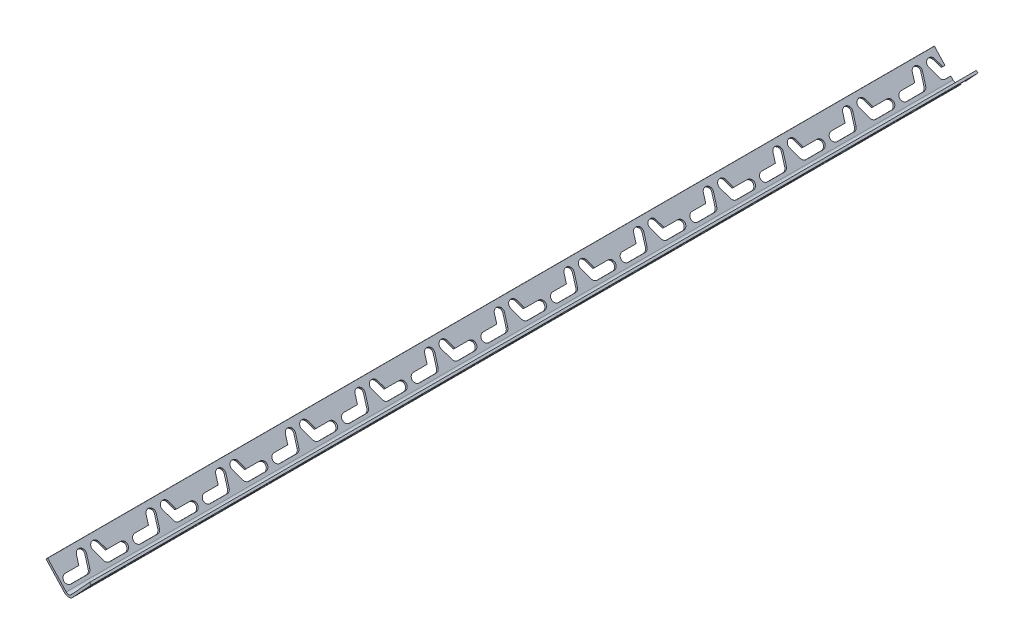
SolidWorks part; units mm, degrees
ref_plane "Face" through (0, 0, 0) normal (0, 0, 1) x (1, 0, 0)
ref_plane "Dessus" through (0, 0, 0) normal (0, 1, 0) x (1, 0, 0)
ref_plane "Droite" through (0, 0, 0) normal (1, 0, 0) x (0, 0, -1)
sketch "Esquisse1" plane through (0, 0, 0) normal (0, 0, 1) x (1, 0, 0)
  line L0 (-20.393, 14.6474) -> (-3.6671, -3.3988)
  line L1 (3.6671, -3.3988) -> (20.393, 14.6474)
  line L2 (20.393, 14.6474) -> (18.9261, 16.0069)
  line L3 (18.9261, 16.0069) -> (2.2003, -2.0393)
  line L4 (-2.2003, -2.0393) -> (-18.9261, 16.0069)
  line L5 (-18.9261, 16.0069) -> (-20.393, 14.6474)
  arc A0 (2.2003, -2.0393) -> (-2.2003, -2.0393) centre (0, 0) cw
  arc A1 (3.6671, -3.3988) -> (-3.6671, -3.3988) centre (0, 0) cw
  point P10 (0, -7.3555)
  dimension "D5" = 3
  dimension "D6" = 5
  dimension "D1" = 30
  dimension "D2" = 30
  dimension "D3" = 2
  dimension "D4" = 2
extrude "Extrusion1" add sketch "Esquisse1" along normal blind 800
sketch "Esquisse2" plane through (-2.2003, -2.0393, 0) normal (0.7334, 0.6798, 0) x (0, 0, -1)
  line L0 (-793.6651, 2.8299) -> (-778.6651, 2.8299)
  line L1 (-793.6651, 10.5869) -> (-781.3809, 10.5869)
  line L2 (-775.0205, 5.3818) -> (-771.6003, 14.7788)
  line L3 (-781.3809, 10.5869) -> (-778.8895, 17.4318)
  line L4 (-800, 24.6053) -> (0, 24.6053) construction
  line L5 (-765.8895, 14.7788) -> (-762.4693, 5.3818)
  line L6 (-758.8247, 2.8299) -> (-743.8247, 2.8299)
  line L7 (-756.109, 10.5869) -> (-743.8247, 10.5869)
  line L8 (-758.6003, 17.4318) -> (-756.109, 10.5869)
  line L9 (-730.8247, 2.8299) -> (-715.8247, 2.8299)
  line L10 (-730.8247, 10.5869) -> (-718.5405, 10.5869)
  line L11 (-712.1801, 5.3818) -> (-708.7599, 14.7788)
  line L12 (-718.5405, 10.5869) -> (-716.0491, 17.4318)
  line L13 (-703.0491, 14.7788) -> (-699.6289, 5.3818)
  line L14 (-695.9843, 2.8299) -> (-680.9843, 2.8299)
  line L15 (-693.2686, 10.5869) -> (-680.9843, 10.5869)
  line L16 (-695.7599, 17.4318) -> (-693.2686, 10.5869)
  line L17 (-667.9843, 2.8299) -> (-652.9843, 2.8299)
  line L18 (-667.9843, 10.5869) -> (-655.7001, 10.5869)
  line L19 (-649.3397, 5.3818) -> (-645.9195, 14.7788)
  line L20 (-655.7001, 10.5869) -> (-653.2087, 17.4318)
  line L21 (-640.2087, 14.7788) -> (-636.7885, 5.3818)
  line L22 (-633.1439, 2.8299) -> (-618.1439, 2.8299)
  line L23 (-630.4282, 10.5869) -> (-618.1439, 10.5869)
  line L24 (-632.9195, 17.4318) -> (-630.4282, 10.5869)
  line L25 (-605.1439, 2.8299) -> (-590.1439, 2.8299)
  line L26 (-605.1439, 10.5869) -> (-592.8597, 10.5869)
  line L27 (-586.4993, 5.3818) -> (-583.0791, 14.7788)
  line L28 (-592.8597, 10.5869) -> (-590.3683, 17.4318)
  line L29 (-577.3683, 14.7788) -> (-573.9481, 5.3818)
  line L30 (-570.3035, 2.8299) -> (-555.3035, 2.8299)
  line L31 (-567.5878, 10.5869) -> (-555.3035, 10.5869)
  line L32 (-570.0791, 17.4318) -> (-567.5878, 10.5869)
  line L33 (-542.3035, 2.8299) -> (-527.3035, 2.8299)
  line L34 (-542.3035, 10.5869) -> (-530.0193, 10.5869)
  line L35 (-523.6589, 5.3818) -> (-520.2387, 14.7788)
  line L36 (-530.0193, 10.5869) -> (-527.5279, 17.4318)
  line L37 (-514.5279, 14.7788) -> (-511.1077, 5.3818)
  line L38 (-507.4631, 2.8299) -> (-492.4631, 2.8299)
  line L39 (-504.7473, 10.5869) -> (-492.4631, 10.5869)
  line L40 (-507.2387, 17.4318) -> (-504.7473, 10.5869)
  line L41 (-479.4631, 2.8299) -> (-464.4631, 2.8299)
  line L42 (-479.4631, 10.5869) -> (-467.1789, 10.5869)
  line L43 (-460.8185, 5.3818) -> (-457.3983, 14.7788)
  line L44 (-467.1789, 10.5869) -> (-464.6875, 17.4318)
  line L45 (-451.6875, 14.7788) -> (-448.2673, 5.3818)
  line L46 (-444.6227, 2.8299) -> (-429.6227, 2.8299)
  line L47 (-441.9069, 10.5869) -> (-429.6227, 10.5869)
  line L48 (-444.3983, 17.4318) -> (-441.9069, 10.5869)
  line L49 (-416.6227, 2.8299) -> (-401.6227, 2.8299)
  line L50 (-416.6227, 10.5869) -> (-404.3385, 10.5869)
  line L51 (-397.9781, 5.3818) -> (-394.5579, 14.7788)
  line L52 (-404.3385, 10.5869) -> (-401.8471, 17.4318)
  line L53 (-388.8471, 14.7788) -> (-385.4269, 5.3818)
  line L54 (-381.7823, 2.8299) -> (-366.7823, 2.8299)
  line L55 (-379.0665, 10.5869) -> (-366.7823, 10.5869)
  line L56 (-381.5579, 17.4318) -> (-379.0665, 10.5869)
  line L57 (-353.7823, 2.8299) -> (-338.7823, 2.8299)
  line L58 (-353.7823, 10.5869) -> (-341.4981, 10.5869)
  line L59 (-335.1377, 5.3818) -> (-331.7175, 14.7788)
  line L60 (-341.4981, 10.5869) -> (-339.0067, 17.4318)
  line L61 (-326.0067, 14.7788) -> (-322.5865, 5.3818)
  line L62 (-318.9419, 2.8299) -> (-303.9419, 2.8299)
  line L63 (-316.2261, 10.5869) -> (-303.9419, 10.5869)
  line L64 (-318.7175, 17.4318) -> (-316.2261, 10.5869)
  line L65 (-290.9419, 2.8299) -> (-275.9419, 2.8299)
  line L66 (-290.9419, 10.5869) -> (-278.6577, 10.5869)
  line L67 (-272.2973, 5.3818) -> (-268.8771, 14.7788)
  line L68 (-278.6577, 10.5869) -> (-276.1663, 17.4318)
  line L69 (-263.1663, 14.7788) -> (-259.7461, 5.3818)
  line L70 (-256.1015, 2.8299) -> (-241.1015, 2.8299)
  line L71 (-253.3857, 10.5869) -> (-241.1015, 10.5869)
  line L72 (-255.8771, 17.4318) -> (-253.3857, 10.5869)
  line L73 (-228.1015, 2.8299) -> (-213.1015, 2.8299)
  line L74 (-228.1015, 10.5869) -> (-215.8172, 10.5869)
  line L75 (-209.4569, 5.3818) -> (-206.0367, 14.7788)
  line L76 (-215.8172, 10.5869) -> (-213.3259, 17.4318)
  line L77 (-200.3259, 14.7788) -> (-196.9057, 5.3818)
  line L78 (-193.2611, 2.8299) -> (-178.2611, 2.8299)
  line L79 (-190.5453, 10.5869) -> (-178.2611, 10.5869)
  line L80 (-193.0367, 17.4318) -> (-190.5453, 10.5869)
  line L81 (-165.2611, 2.8299) -> (-150.2611, 2.8299)
  line L82 (-165.2611, 10.5869) -> (-152.9768, 10.5869)
  line L83 (-146.6165, 5.3818) -> (-143.1963, 14.7788)
  line L84 (-152.9768, 10.5869) -> (-150.4855, 17.4318)
  line L85 (-137.4855, 14.7788) -> (-134.0653, 5.3818)
  line L86 (-130.4207, 2.8299) -> (-115.4207, 2.8299)
  line L87 (-127.7049, 10.5869) -> (-115.4207, 10.5869)
  line L88 (-130.1963, 17.4318) -> (-127.7049, 10.5869)
  line L89 (-102.4207, 2.8299) -> (-87.4207, 2.8299)
  line L90 (-102.4207, 10.5869) -> (-90.1364, 10.5869)
  line L91 (-83.7761, 5.3818) -> (-80.3559, 14.7788)
  line L92 (-90.1364, 10.5869) -> (-87.6451, 17.4318)
  line L93 (-74.6451, 14.7788) -> (-71.2249, 5.3818)
  line L94 (-67.5803, 2.8299) -> (-52.5803, 2.8299)
  line L95 (-64.8645, 10.5869) -> (-52.5803, 10.5869)
  line L96 (-67.3559, 17.4318) -> (-64.8645, 10.5869)
  line L97 (-39.5803, 2.8299) -> (-24.5803, 2.8299)
  line L98 (-39.5803, 10.5869) -> (-27.296, 10.5869)
  line L99 (-20.9357, 5.3818) -> (-17.5155, 14.7788)
  line L100 (-27.296, 10.5869) -> (-24.8047, 17.4318)
  line L101 (-11.8047, 14.7788) -> (-8.3845, 5.3818)
  line L102 (-4.7399, 2.8299) -> (10.2601, 2.8299)
  line L103 (-2.0241, 10.5869) -> (10.2601, 10.5869)
  line L104 (-4.5155, 17.4318) -> (-2.0241, 10.5869)
  line L105 (23.2601, 10.5869) -> (35.5444, 10.5869)
  line L106 (41.9047, 5.3818) -> (45.3249, 14.7788)
  line L107 (35.5444, 10.5869) -> (38.0357, 17.4318)
  line L108 (51.0357, 14.7788) -> (54.4559, 5.3818)
  line L109 (58.1005, 2.8299) -> (73.1005, 2.8299)
  line L110 (60.8163, 10.5869) -> (73.1005, 10.5869)
  line L111 (58.3249, 17.4318) -> (60.8163, 10.5869)
  line L113 (23.2601, 2.8299) -> (38.2601, 2.8299)
  arc A0 (-793.6651, 10.5869) -> (-793.6651, 2.8299) centre (-793.6651, 6.7084) ccw
  arc A1 (-778.6651, 2.8299) -> (-775.0205, 5.3818) centre (-778.6651, 6.7084) ccw
  arc A2 (-771.6003, 14.7788) -> (-778.8895, 17.4318) centre (-775.2449, 16.1053) ccw
  arc A3 (-762.4693, 5.3818) -> (-758.8247, 2.8299) centre (-758.8247, 6.7084) ccw
  arc A4 (-743.8247, 2.8299) -> (-743.8247, 10.5869) centre (-743.8247, 6.7084) ccw
  arc A5 (-758.6003, 17.4318) -> (-765.8895, 14.7788) centre (-762.2449, 16.1053) ccw
  arc A6 (-730.8247, 10.5869) -> (-730.8247, 2.8299) centre (-730.8247, 6.7084) ccw
  arc A7 (-715.8247, 2.8299) -> (-712.1801, 5.3818) centre (-715.8247, 6.7084) ccw
  arc A8 (-708.7599, 14.7788) -> (-716.0491, 17.4318) centre (-712.4045, 16.1053) ccw
  arc A9 (-699.6289, 5.3818) -> (-695.9843, 2.8299) centre (-695.9843, 6.7084) ccw
  arc A10 (-680.9843, 2.8299) -> (-680.9843, 10.5869) centre (-680.9843, 6.7084) ccw
  arc A11 (-695.7599, 17.4318) -> (-703.0491, 14.7788) centre (-699.4045, 16.1053) ccw
  arc A12 (-667.9843, 10.5869) -> (-667.9843, 2.8299) centre (-667.9843, 6.7084) ccw
  arc A13 (-652.9843, 2.8299) -> (-649.3397, 5.3818) centre (-652.9843, 6.7084) ccw
  arc A14 (-645.9195, 14.7788) -> (-653.2087, 17.4318) centre (-649.5641, 16.1053) ccw
  arc A15 (-636.7885, 5.3818) -> (-633.1439, 2.8299) centre (-633.1439, 6.7084) ccw
  arc A16 (-618.1439, 2.8299) -> (-618.1439, 10.5869) centre (-618.1439, 6.7084) ccw
  arc A17 (-632.9195, 17.4318) -> (-640.2087, 14.7788) centre (-636.5641, 16.1053) ccw
  arc A18 (-605.1439, 10.5869) -> (-605.1439, 2.8299) centre (-605.1439, 6.7084) ccw
  arc A19 (-590.1439, 2.8299) -> (-586.4993, 5.3818) centre (-590.1439, 6.7084) ccw
  arc A20 (-583.0791, 14.7788) -> (-590.3683, 17.4318) centre (-586.7237, 16.1053) ccw
  arc A21 (-573.9481, 5.3818) -> (-570.3035, 2.8299) centre (-570.3035, 6.7084) ccw
  arc A22 (-555.3035, 2.8299) -> (-555.3035, 10.5869) centre (-555.3035, 6.7084) ccw
  arc A23 (-570.0791, 17.4318) -> (-577.3683, 14.7788) centre (-573.7237, 16.1053) ccw
  arc A24 (-542.3035, 10.5869) -> (-542.3035, 2.8299) centre (-542.3035, 6.7084) ccw
  arc A25 (-527.3035, 2.8299) -> (-523.6589, 5.3818) centre (-527.3035, 6.7084) ccw
  arc A26 (-520.2387, 14.7788) -> (-527.5279, 17.4318) centre (-523.8833, 16.1053) ccw
  arc A27 (-511.1077, 5.3818) -> (-507.4631, 2.8299) centre (-507.4631, 6.7084) ccw
  arc A28 (-492.4631, 2.8299) -> (-492.4631, 10.5869) centre (-492.4631, 6.7084) ccw
  arc A29 (-507.2387, 17.4318) -> (-514.5279, 14.7788) centre (-510.8833, 16.1053) ccw
  arc A30 (-479.4631, 10.5869) -> (-479.4631, 2.8299) centre (-479.4631, 6.7084) ccw
  arc A31 (-464.4631, 2.8299) -> (-460.8185, 5.3818) centre (-464.4631, 6.7084) ccw
  arc A32 (-457.3983, 14.7788) -> (-464.6875, 17.4318) centre (-461.0429, 16.1053) ccw
  arc A33 (-448.2673, 5.3818) -> (-444.6227, 2.8299) centre (-444.6227, 6.7084) ccw
  arc A34 (-429.6227, 2.8299) -> (-429.6227, 10.5869) centre (-429.6227, 6.7084) ccw
  arc A35 (-444.3983, 17.4318) -> (-451.6875, 14.7788) centre (-448.0429, 16.1053) ccw
  arc A36 (-416.6227, 10.5869) -> (-416.6227, 2.8299) centre (-416.6227, 6.7084) ccw
  arc A37 (-401.6227, 2.8299) -> (-397.9781, 5.3818) centre (-401.6227, 6.7084) ccw
  arc A38 (-394.5579, 14.7788) -> (-401.8471, 17.4318) centre (-398.2025, 16.1053) ccw
  arc A39 (-385.4269, 5.3818) -> (-381.7823, 2.8299) centre (-381.7823, 6.7084) ccw
  arc A40 (-366.7823, 2.8299) -> (-366.7823, 10.5869) centre (-366.7823, 6.7084) ccw
  arc A41 (-381.5579, 17.4318) -> (-388.8471, 14.7788) centre (-385.2025, 16.1053) ccw
  arc A42 (-353.7823, 10.5869) -> (-353.7823, 2.8299) centre (-353.7823, 6.7084) ccw
  arc A43 (-338.7823, 2.8299) -> (-335.1377, 5.3818) centre (-338.7823, 6.7084) ccw
  arc A44 (-331.7175, 14.7788) -> (-339.0067, 17.4318) centre (-335.3621, 16.1053) ccw
  arc A45 (-322.5865, 5.3818) -> (-318.9419, 2.8299) centre (-318.9419, 6.7084) ccw
  arc A46 (-303.9419, 2.8299) -> (-303.9419, 10.5869) centre (-303.9419, 6.7084) ccw
  arc A47 (-318.7175, 17.4318) -> (-326.0067, 14.7788) centre (-322.3621, 16.1053) ccw
  arc A48 (-290.9419, 10.5869) -> (-290.9419, 2.8299) centre (-290.9419, 6.7084) ccw
  arc A49 (-275.9419, 2.8299) -> (-272.2973, 5.3818) centre (-275.9419, 6.7084) ccw
  arc A50 (-268.8771, 14.7788) -> (-276.1663, 17.4318) centre (-272.5217, 16.1053) ccw
  arc A51 (-259.7461, 5.3818) -> (-256.1015, 2.8299) centre (-256.1015, 6.7084) ccw
  arc A52 (-241.1015, 2.8299) -> (-241.1015, 10.5869) centre (-241.1015, 6.7084) ccw
  arc A53 (-255.8771, 17.4318) -> (-263.1663, 14.7788) centre (-259.5217, 16.1053) ccw
  arc A54 (-228.1015, 10.5869) -> (-228.1015, 2.8299) centre (-228.1015, 6.7084) ccw
  arc A55 (-213.1015, 2.8299) -> (-209.4569, 5.3818) centre (-213.1015, 6.7084) ccw
  arc A56 (-206.0367, 14.7788) -> (-213.3259, 17.4318) centre (-209.6813, 16.1053) ccw
  arc A57 (-196.9057, 5.3818) -> (-193.2611, 2.8299) centre (-193.2611, 6.7084) ccw
  arc A58 (-178.2611, 2.8299) -> (-178.2611, 10.5869) centre (-178.2611, 6.7084) ccw
  arc A59 (-193.0367, 17.4318) -> (-200.3259, 14.7788) centre (-196.6813, 16.1053) ccw
  arc A60 (-165.2611, 10.5869) -> (-165.2611, 2.8299) centre (-165.2611, 6.7084) ccw
  arc A61 (-150.2611, 2.8299) -> (-146.6165, 5.3818) centre (-150.2611, 6.7084) ccw
  arc A62 (-143.1963, 14.7788) -> (-150.4855, 17.4318) centre (-146.8409, 16.1053) ccw
  arc A63 (-134.0653, 5.3818) -> (-130.4207, 2.8299) centre (-130.4207, 6.7084) ccw
  arc A64 (-115.4207, 2.8299) -> (-115.4207, 10.5869) centre (-115.4207, 6.7084) ccw
  arc A65 (-130.1963, 17.4318) -> (-137.4855, 14.7788) centre (-133.8409, 16.1053) ccw
  arc A66 (-102.4207, 10.5869) -> (-102.4207, 2.8299) centre (-102.4207, 6.7084) ccw
  arc A67 (-87.4207, 2.8299) -> (-83.7761, 5.3818) centre (-87.4207, 6.7084) ccw
  arc A68 (-80.3559, 14.7788) -> (-87.6451, 17.4318) centre (-84.0005, 16.1053) ccw
  arc A69 (-71.2249, 5.3818) -> (-67.5803, 2.8299) centre (-67.5803, 6.7084) ccw
  arc A70 (-52.5803, 2.8299) -> (-52.5803, 10.5869) centre (-52.5803, 6.7084) ccw
  arc A71 (-67.3559, 17.4318) -> (-74.6451, 14.7788) centre (-71.0005, 16.1053) ccw
  arc A72 (-39.5803, 10.5869) -> (-39.5803, 2.8299) centre (-39.5803, 6.7084) ccw
  arc A73 (-24.5803, 2.8299) -> (-20.9357, 5.3818) centre (-24.5803, 6.7084) ccw
  arc A74 (-17.5155, 14.7788) -> (-24.8047, 17.4318) centre (-21.1601, 16.1053) ccw
  arc A75 (-8.3845, 5.3818) -> (-4.7399, 2.8299) centre (-4.7399, 6.7084) ccw
  arc A76 (10.2601, 2.8299) -> (10.2601, 10.5869) centre (10.2601, 6.7084) ccw
  arc A77 (-4.5155, 17.4318) -> (-11.8047, 14.7788) centre (-8.1601, 16.1053) ccw
  arc A78 (38.2601, 2.8299) -> (41.9047, 5.3818) centre (38.2601, 6.7084) ccw
  arc A79 (45.3249, 14.7788) -> (38.0357, 17.4318) centre (41.6803, 16.1053) ccw
  arc A80 (54.4559, 5.3818) -> (58.1005, 2.8299) centre (58.1005, 6.7084) ccw
  arc A81 (73.1005, 2.8299) -> (73.1005, 10.5869) centre (73.1005, 6.7084) ccw
  arc A82 (58.3249, 17.4318) -> (51.0357, 14.7788) centre (54.6803, 16.1053) ccw
  arc A84 (23.2601, 10.5869) -> (23.2601, 2.8299) centre (23.2601, 6.7084) ccw
  dimension "D1" = 8.5
  dimension "D2" = 15
  dimension "D3" = 10
  dimension "D4" = 10
  dimension "D5" = 15
  dimension "D6" = 110
  dimension "D7" = 110
  dimension "D8" = 13
  dimension "D9" = 13
  dimension "D10" = 13
extrude "Enlèv. mat.-Extru.1" cut sketch "Esquisse2" against normal blind 10
sketch "Esquisse5" plane through (2.2003, -2.0393, 0) normal (-0.7334, 0.6798, 0) x (0, 0, 1)
  line L0 (-10.9195, 1.907) -> (4.0805, 1.907)
  line L1 (-10.9195, 9.664) -> (1.3648, 9.664)
  line L2 (7.7251, 4.4589) -> (11.1453, 13.8559)
  line L3 (1.3648, 9.664) -> (3.8561, 16.5089)
  line L4 (16.8561, 13.8559) -> (20.2763, 4.4589)
  line L5 (23.9209, 1.907) -> (38.9209, 1.907)
  line L6 (26.6367, 9.664) -> (38.9209, 9.664)
  line L7 (24.1453, 16.5089) -> (26.6367, 9.664)
  line L8 (51.9209, 1.907) -> (66.9209, 1.907)
  line L9 (51.9209, 9.664) -> (64.2052, 9.664)
  line L10 (70.5655, 4.4589) -> (73.9857, 13.8559)
  line L11 (64.2052, 9.664) -> (66.6965, 16.5089)
  line L12 (79.6965, 13.8559) -> (83.1167, 4.4589)
  line L13 (86.7613, 1.907) -> (101.7613, 1.907)
  line L14 (89.4771, 9.664) -> (101.7613, 9.664)
  line L15 (86.9857, 16.5089) -> (89.4771, 9.664)
  line L16 (114.7613, 1.907) -> (129.7613, 1.907)
  line L17 (114.7613, 9.664) -> (127.0456, 9.664)
  line L18 (133.4059, 4.4589) -> (136.8261, 13.8559)
  line L19 (127.0456, 9.664) -> (129.5369, 16.5089)
  line L20 (142.5369, 13.8559) -> (145.9571, 4.4589)
  line L21 (149.6017, 1.907) -> (164.6017, 1.907)
  line L22 (152.3175, 9.664) -> (164.6017, 9.664)
  line L23 (149.8261, 16.5089) -> (152.3175, 9.664)
  line L24 (177.6017, 1.907) -> (192.6017, 1.907)
  line L25 (177.6017, 9.664) -> (189.886, 9.664)
  line L26 (196.2463, 4.4589) -> (199.6665, 13.8559)
  line L27 (189.886, 9.664) -> (192.3773, 16.5089)
  line L28 (205.3773, 13.8559) -> (208.7975, 4.4589)
  line L29 (212.4421, 1.907) -> (227.4421, 1.907)
  line L30 (215.1579, 9.664) -> (227.4421, 9.664)
  line L31 (212.6665, 16.5089) -> (215.1579, 9.664)
  line L32 (240.4421, 1.907) -> (255.4421, 1.907)
  line L33 (240.4421, 9.664) -> (252.7264, 9.664)
  line L34 (259.0867, 4.4589) -> (262.5069, 13.8559)
  line L35 (252.7264, 9.664) -> (255.2178, 16.5089)
  line L36 (268.2178, 13.8559) -> (271.638, 4.4589)
  line L37 (275.2826, 1.907) -> (290.2826, 1.907)
  line L38 (277.9983, 9.664) -> (290.2826, 9.664)
  line L39 (275.5069, 16.5089) -> (277.9983, 9.664)
  line L40 (303.2826, 1.907) -> (318.2826, 1.907)
  line L41 (303.2826, 9.664) -> (315.5668, 9.664)
  line L42 (321.9272, 4.4589) -> (325.3474, 13.8559)
  line L43 (315.5668, 9.664) -> (318.0582, 16.5089)
  line L44 (331.0582, 13.8559) -> (334.4784, 4.4589)
  line L45 (338.123, 1.907) -> (353.123, 1.907)
  line L46 (340.8387, 9.664) -> (353.123, 9.664)
  line L47 (338.3474, 16.5089) -> (340.8387, 9.664)
  line L48 (366.123, 1.907) -> (381.123, 1.907)
  line L49 (366.123, 9.664) -> (378.4072, 9.664)
  line L50 (384.7676, 4.4589) -> (388.1878, 13.8559)
  line L51 (378.4072, 9.664) -> (380.8986, 16.5089)
  line L52 (393.8986, 13.8559) -> (397.3188, 4.4589)
  line L53 (400.9634, 1.907) -> (415.9634, 1.907)
  line L54 (403.6791, 9.664) -> (415.9634, 9.664)
  line L55 (401.1878, 16.5089) -> (403.6791, 9.664)
  line L56 (428.9634, 1.907) -> (443.9634, 1.907)
  line L57 (428.9634, 9.664) -> (441.2476, 9.664)
  line L58 (447.608, 4.4589) -> (451.0282, 13.8559)
  line L59 (441.2476, 9.664) -> (443.739, 16.5089)
  line L60 (456.739, 13.8559) -> (460.1592, 4.4589)
  line L61 (463.8038, 1.907) -> (478.8038, 1.907)
  line L62 (466.5195, 9.664) -> (478.8038, 9.664)
  line L63 (464.0282, 16.5089) -> (466.5195, 9.664)
  line L64 (491.8038, 1.907) -> (506.8038, 1.907)
  line L65 (491.8038, 9.664) -> (504.088, 9.664)
  line L66 (510.4484, 4.4589) -> (513.8686, 13.8559)
  line L67 (504.088, 9.664) -> (506.5794, 16.5089)
  line L68 (519.5794, 13.8559) -> (522.9996, 4.4589)
  line L69 (526.6442, 1.907) -> (541.6442, 1.907)
  line L70 (529.3599, 9.664) -> (541.6442, 9.664)
  line L71 (526.8686, 16.5089) -> (529.3599, 9.664)
  line L72 (554.6442, 1.907) -> (569.6442, 1.907)
  line L73 (554.6442, 9.664) -> (566.9284, 9.664)
  line L74 (573.2888, 4.4589) -> (576.709, 13.8559)
  line L75 (566.9284, 9.664) -> (569.4198, 16.5089)
  line L76 (582.4198, 13.8559) -> (585.84, 4.4589)
  line L77 (589.4846, 1.907) -> (604.4846, 1.907)
  line L78 (592.2003, 9.664) -> (604.4846, 9.664)
  line L79 (589.709, 16.5089) -> (592.2003, 9.664)
  line L80 (617.4846, 1.907) -> (632.4846, 1.907)
  line L81 (617.4846, 9.664) -> (629.7688, 9.664)
  line L82 (636.1292, 4.4589) -> (639.5494, 13.8559)
  line L83 (629.7688, 9.664) -> (632.2602, 16.5089)
  line L84 (645.2602, 13.8559) -> (648.6804, 4.4589)
  line L85 (652.325, 1.907) -> (667.325, 1.907)
  line L86 (655.0407, 9.664) -> (667.325, 9.664)
  line L87 (652.5494, 16.5089) -> (655.0407, 9.664)
  line L88 (680.325, 1.907) -> (695.325, 1.907)
  line L89 (680.325, 9.664) -> (692.6092, 9.664)
  line L90 (698.9696, 4.4589) -> (702.3898, 13.8559)
  line L91 (692.6092, 9.664) -> (695.1006, 16.5089)
  line L92 (708.1006, 13.8559) -> (711.5208, 4.4589)
  line L93 (715.1654, 1.907) -> (730.1654, 1.907)
  line L94 (717.8811, 9.664) -> (730.1654, 9.664)
  line L95 (715.3898, 16.5089) -> (717.8811, 9.664)
  line L96 (743.1654, 1.907) -> (758.1654, 1.907)
  line L97 (743.1654, 9.664) -> (755.4496, 9.664)
  line L98 (761.81, 4.4589) -> (765.2302, 13.8559)
  line L99 (755.4496, 9.664) -> (757.941, 16.5089)
  line L100 (770.941, 13.8559) -> (774.3612, 4.4589)
  line L101 (778.0058, 1.907) -> (793.0058, 1.907)
  line L102 (780.7215, 9.664) -> (793.0058, 9.664)
  line L103 (778.2302, 16.5089) -> (780.7215, 9.664)
  arc A0 (-10.9195, 9.664) -> (-10.9195, 1.907) centre (-10.9195, 5.7855) ccw
  arc A1 (4.0805, 1.907) -> (7.7251, 4.4589) centre (4.0805, 5.7855) ccw
  arc A2 (11.1453, 13.8559) -> (3.8561, 16.5089) centre (7.5007, 15.1824) ccw
  arc A3 (20.2763, 4.4589) -> (23.9209, 1.907) centre (23.9209, 5.7855) ccw
  arc A4 (38.9209, 1.907) -> (38.9209, 9.664) centre (38.9209, 5.7855) ccw
  arc A5 (24.1453, 16.5089) -> (16.8561, 13.8559) centre (20.5007, 15.1824) ccw
  arc A6 (51.9209, 9.664) -> (51.9209, 1.907) centre (51.9209, 5.7855) ccw
  arc A7 (66.9209, 1.907) -> (70.5655, 4.4589) centre (66.9209, 5.7855) ccw
  arc A8 (73.9857, 13.8559) -> (66.6965, 16.5089) centre (70.3411, 15.1824) ccw
  arc A9 (83.1167, 4.4589) -> (86.7613, 1.907) centre (86.7613, 5.7855) ccw
  arc A10 (101.7613, 1.907) -> (101.7613, 9.664) centre (101.7613, 5.7855) ccw
  arc A11 (86.9857, 16.5089) -> (79.6965, 13.8559) centre (83.3411, 15.1824) ccw
  arc A12 (114.7613, 9.664) -> (114.7613, 1.907) centre (114.7613, 5.7855) ccw
  arc A13 (129.7613, 1.907) -> (133.4059, 4.4589) centre (129.7613, 5.7855) ccw
  arc A14 (136.8261, 13.8559) -> (129.5369, 16.5089) centre (133.1815, 15.1824) ccw
  arc A15 (145.9571, 4.4589) -> (149.6017, 1.907) centre (149.6017, 5.7855) ccw
  arc A16 (164.6017, 1.907) -> (164.6017, 9.664) centre (164.6017, 5.7855) ccw
  arc A17 (149.8261, 16.5089) -> (142.5369, 13.8559) centre (146.1815, 15.1824) ccw
  arc A18 (177.6017, 9.664) -> (177.6017, 1.907) centre (177.6017, 5.7855) ccw
  arc A19 (192.6017, 1.907) -> (196.2463, 4.4589) centre (192.6017, 5.7855) ccw
  arc A20 (199.6665, 13.8559) -> (192.3773, 16.5089) centre (196.0219, 15.1824) ccw
  arc A21 (208.7975, 4.4589) -> (212.4421, 1.907) centre (212.4421, 5.7855) ccw
  arc A22 (227.4421, 1.907) -> (227.4421, 9.664) centre (227.4421, 5.7855) ccw
  arc A23 (212.6665, 16.5089) -> (205.3773, 13.8559) centre (209.0219, 15.1824) ccw
  arc A24 (240.4421, 9.664) -> (240.4421, 1.907) centre (240.4421, 5.7855) ccw
  arc A25 (255.4421, 1.907) -> (259.0867, 4.4589) centre (255.4421, 5.7855) ccw
  arc A26 (262.5069, 13.8559) -> (255.2178, 16.5089) centre (258.8623, 15.1824) ccw
  arc A27 (271.638, 4.4589) -> (275.2826, 1.907) centre (275.2826, 5.7855) ccw
  arc A28 (290.2826, 1.907) -> (290.2826, 9.664) centre (290.2826, 5.7855) ccw
  arc A29 (275.5069, 16.5089) -> (268.2178, 13.8559) centre (271.8623, 15.1824) ccw
  arc A30 (303.2826, 9.664) -> (303.2826, 1.907) centre (303.2826, 5.7855) ccw
  arc A31 (318.2826, 1.907) -> (321.9272, 4.4589) centre (318.2826, 5.7855) ccw
  arc A32 (325.3474, 13.8559) -> (318.0582, 16.5089) centre (321.7028, 15.1824) ccw
  arc A33 (334.4784, 4.4589) -> (338.123, 1.907) centre (338.123, 5.7855) ccw
  arc A34 (353.123, 1.907) -> (353.123, 9.664) centre (353.123, 5.7855) ccw
  arc A35 (338.3474, 16.5089) -> (331.0582, 13.8559) centre (334.7028, 15.1824) ccw
  arc A36 (366.123, 9.664) -> (366.123, 1.907) centre (366.123, 5.7855) ccw
  arc A37 (381.123, 1.907) -> (384.7676, 4.4589) centre (381.123, 5.7855) ccw
  arc A38 (388.1878, 13.8559) -> (380.8986, 16.5089) centre (384.5432, 15.1824) ccw
  arc A39 (397.3188, 4.4589) -> (400.9634, 1.907) centre (400.9634, 5.7855) ccw
  arc A40 (415.9634, 1.907) -> (415.9634, 9.664) centre (415.9634, 5.7855) ccw
  arc A41 (401.1878, 16.5089) -> (393.8986, 13.8559) centre (397.5432, 15.1824) ccw
  arc A42 (428.9634, 9.664) -> (428.9634, 1.907) centre (428.9634, 5.7855) ccw
  arc A43 (443.9634, 1.907) -> (447.608, 4.4589) centre (443.9634, 5.7855) ccw
  arc A44 (451.0282, 13.8559) -> (443.739, 16.5089) centre (447.3836, 15.1824) ccw
  arc A45 (460.1592, 4.4589) -> (463.8038, 1.907) centre (463.8038, 5.7855) ccw
  arc A46 (478.8038, 1.907) -> (478.8038, 9.664) centre (478.8038, 5.7855) ccw
  arc A47 (464.0282, 16.5089) -> (456.739, 13.8559) centre (460.3836, 15.1824) ccw
  arc A48 (491.8038, 9.664) -> (491.8038, 1.907) centre (491.8038, 5.7855) ccw
  arc A49 (506.8038, 1.907) -> (510.4484, 4.4589) centre (506.8038, 5.7855) ccw
  arc A50 (513.8686, 13.8559) -> (506.5794, 16.5089) centre (510.224, 15.1824) ccw
  arc A51 (522.9996, 4.4589) -> (526.6442, 1.907) centre (526.6442, 5.7855) ccw
  arc A52 (541.6442, 1.907) -> (541.6442, 9.664) centre (541.6442, 5.7855) ccw
  arc A53 (526.8686, 16.5089) -> (519.5794, 13.8559) centre (523.224, 15.1824) ccw
  arc A54 (554.6442, 9.664) -> (554.6442, 1.907) centre (554.6442, 5.7855) ccw
  arc A55 (569.6442, 1.907) -> (573.2888, 4.4589) centre (569.6442, 5.7855) ccw
  arc A56 (576.709, 13.8559) -> (569.4198, 16.5089) centre (573.0644, 15.1824) ccw
  arc A57 (585.84, 4.4589) -> (589.4846, 1.907) centre (589.4846, 5.7855) ccw
  arc A58 (604.4846, 1.907) -> (604.4846, 9.664) centre (604.4846, 5.7855) ccw
  arc A59 (589.709, 16.5089) -> (582.4198, 13.8559) centre (586.0644, 15.1824) ccw
  arc A60 (617.4846, 9.664) -> (617.4846, 1.907) centre (617.4846, 5.7855) ccw
  arc A61 (632.4846, 1.907) -> (636.1292, 4.4589) centre (632.4846, 5.7855) ccw
  arc A62 (639.5494, 13.8559) -> (632.2602, 16.5089) centre (635.9048, 15.1824) ccw
  arc A63 (648.6804, 4.4589) -> (652.325, 1.907) centre (652.325, 5.7855) ccw
  arc A64 (667.325, 1.907) -> (667.325, 9.664) centre (667.325, 5.7855) ccw
  arc A65 (652.5494, 16.5089) -> (645.2602, 13.8559) centre (648.9048, 15.1824) ccw
  arc A66 (680.325, 9.664) -> (680.325, 1.907) centre (680.325, 5.7855) ccw
  arc A67 (695.325, 1.907) -> (698.9696, 4.4589) centre (695.325, 5.7855) ccw
  arc A68 (702.3898, 13.8559) -> (695.1006, 16.5089) centre (698.7452, 15.1824) ccw
  arc A69 (711.5208, 4.4589) -> (715.1654, 1.907) centre (715.1654, 5.7855) ccw
  arc A70 (730.1654, 1.907) -> (730.1654, 9.664) centre (730.1654, 5.7855) ccw
  arc A71 (715.3898, 16.5089) -> (708.1006, 13.8559) centre (711.7452, 15.1824) ccw
  arc A72 (743.1654, 9.664) -> (743.1654, 1.907) centre (743.1654, 5.7855) ccw
  arc A73 (758.1654, 1.907) -> (761.81, 4.4589) centre (758.1654, 5.7855) ccw
  arc A74 (765.2302, 13.8559) -> (757.941, 16.5089) centre (761.5856, 15.1824) ccw
  arc A75 (774.3612, 4.4589) -> (778.0058, 1.907) centre (778.0058, 5.7855) ccw
  arc A76 (793.0058, 1.907) -> (793.0058, 9.664) centre (793.0058, 5.7855) ccw
  arc A77 (778.2302, 16.5089) -> (770.941, 13.8559) centre (774.5856, 15.1824) ccw
  dimension "D1" = 15
  dimension "D2" = 10
  dimension "D3" = 110
  dimension "D4" = 10
  dimension "D5" = 15
  dimension "D6" = 110
  dimension "D7" = 13
  dimension "D8" = 13
  dimension "D9" = 13
extrude "Enlèv. mat.-Extru.2" cut sketch "Esquisse5" against normal blind 10
